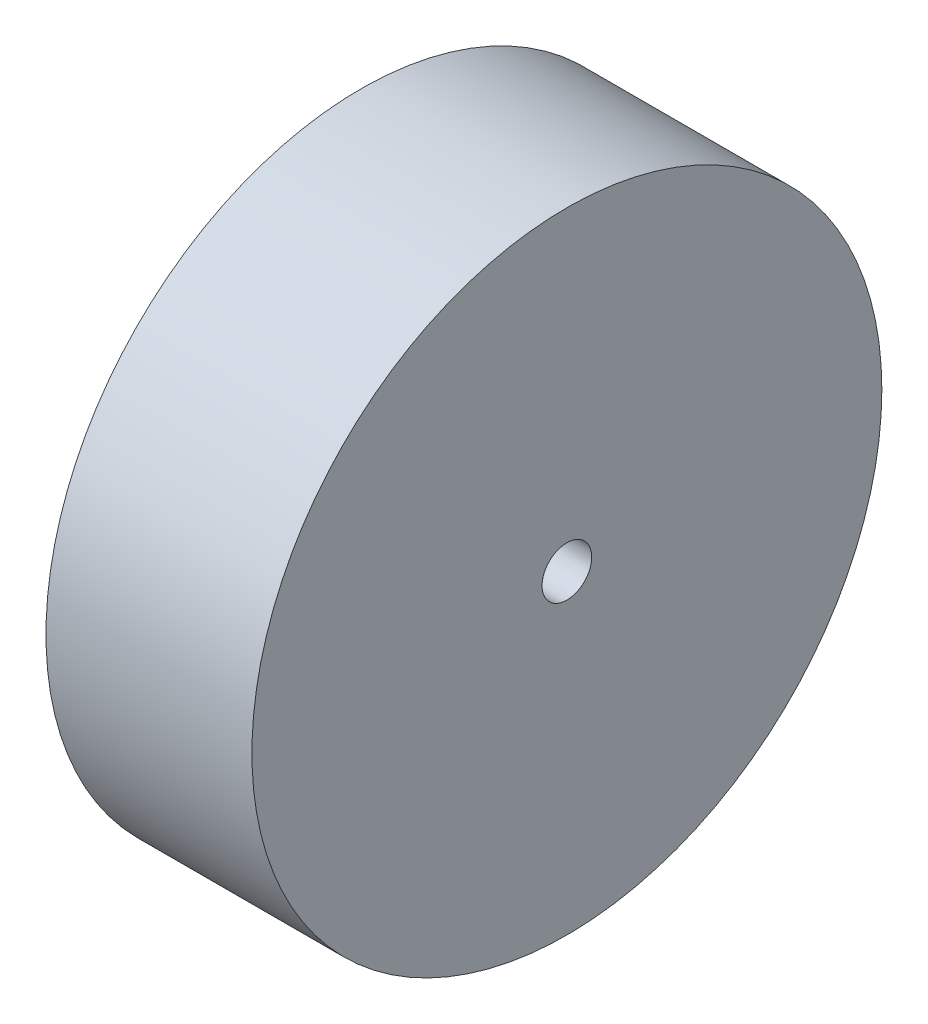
SolidWorks part; units mm, degrees
ref_plane "Front Plane" through (0, 0, 0) normal (0, 0, 1) x (1, 0, 0)
ref_plane "Top Plane" through (0, 0, 0) normal (0, 1, 0) x (1, 0, 0)
ref_plane "Right Plane" through (0, 0, 0) normal (1, 0, 0) x (0, 0, -1)
sketch "Sketch1" plane through (0, 0, 0) normal (1, 0, 0) x (0, 0, -1)
  circle A0 centre (0, 0) radius 26
  circle A1 centre (0, 0) radius 2.05
  dimension "D1" = 52
  dimension "D2" = 4.1
extrude "Boss-Extrude1" add sketch "Sketch1" along normal mid plane 17
